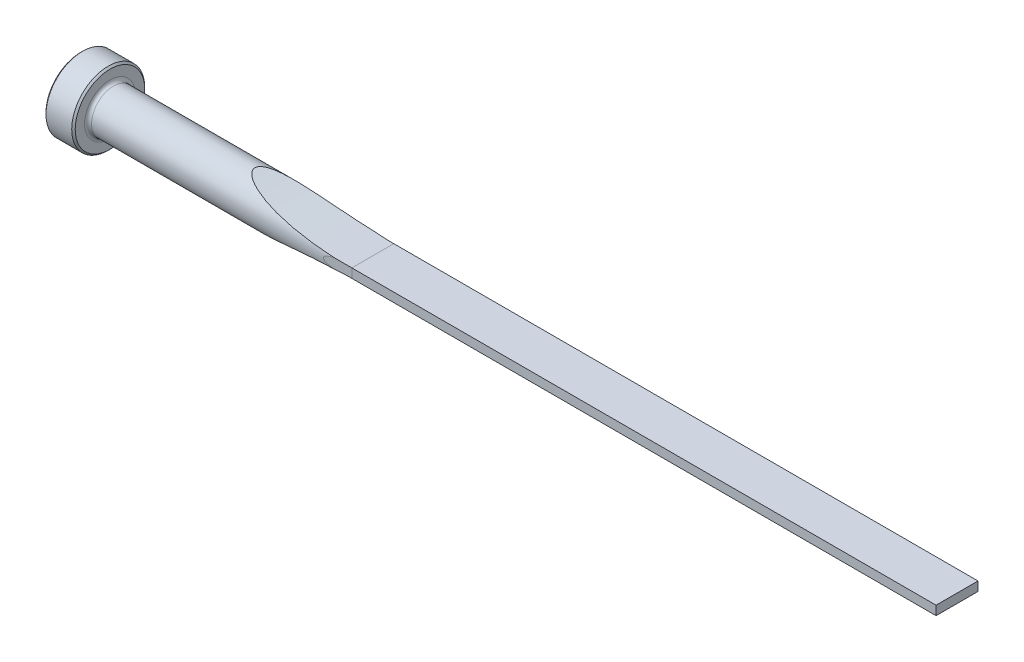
SolidWorks part; units mm, degrees
ref_plane "Front Plane" through (0, 0, 0) normal (0, 0, 1) x (1, 0, 0)
ref_plane "Top Plane" through (0, 0, 0) normal (0, 1, 0) x (1, 0, 0)
ref_plane "Right Plane" through (0, 0, 0) normal (1, 0, 0) x (0, 0, -1)
sketch "Sketch1" plane through (0, 0, 0) normal (0, 0, 1) x (1, 0, 0)
  line L0 (0, 0) -> (175.5286, 0) construction
  line L1 (0, 0) -> (0, 7.9375)
  line L2 (0, 7.9375) -> (6.35, 7.9375)
  line L3 (6.35, 7.9375) -> (6.35, 4.7625)
  line L4 (6.35, 4.7625) -> (190.5, 4.7625)
  line L5 (190.5, 4.7625) -> (190.5, 0)
  line L6 (190.5, 0) -> (0, 0)
  dimension "D1" = 190.5
  dimension "D2" = 15.875
  dimension "D3" = 9.525
  dimension "D4" = 6.35
revolve "Revolve1" add sketch "Sketch1" angle 360 about L0
sketch "Sketch2" plane through (0, 0, 0) normal (0, 0, 1) x (1, 0, 0)
  line L0 (190.5, 4.7625) -> (190.5, 0.9906)
  line L1 (190.5, -4.7625) -> (190.5, 4.7625) construction
  line L2 (190.5, 0.9906) -> (63.5, 0.9906)
  line L3 (190.5, 4.7625) -> (6.35, 4.7625) construction
  line L4 (37.8794, 4.7625) -> (190.5, 4.7625)
  line L5 (166.0833, 0) -> (153.1705, 0) construction
  arc A0 (63.5, 0.9906) -> (37.8794, 4.7625) centre (63.5, 89.8906) cw
  dimension "D1" = 88.9
  dimension "D3" = 127
  dimension "D2" = 1.9812
  dimension "D4" = 25.6206
extrude "Cut-Extrude1" cut sketch "Sketch2" against normal through all both and the other way through all
mirror "Mirror1" about plane through (0, 0, 0) normal (0, 1, 0) of "Cut-Extrude1"
sketch "Sketch3" plane through (0, 0, 0) normal (0, 1, 0) x (1, 0, 0)
  line L0 (190.5, 4.7625) -> (190.5, 4.5593)
  line L1 (190.5, 4.6583) -> (190.5, -4.6583) construction
  line L2 (190.5, 4.5593) -> (63.5, 4.5593)
  line L3 (190.5, 4.7625) -> (6.35, 4.7625) construction
  line L4 (57.4927, 4.7625) -> (190.5, 4.7625)
  line L5 (163.4716, 0) -> (166.2513, 0) construction
  line L6 (63.5, 4.6583) -> (63.5, -4.6583) construction
  arc A0 (63.5, 4.5593) -> (57.4927, 4.7625) centre (63.5, 93.4593) cw
  dimension "D2" = 88.9
  dimension "D1" = 9.1186
extrude "Cut-Extrude2" cut sketch "Sketch3" against normal through all both and the other way through all
mirror "Mirror2" about plane through (0, 0, 0) normal (0, 0, 1) of "Cut-Extrude2"
fillet "Fillet1" radius 0.762 1 edges at (6.35, 0, 4.7625)
chamfer "Chamfer1" distance 0.381 angle 45 2 edges at (0, 0, 7.9375) (6.35, 0, 7.9375)
